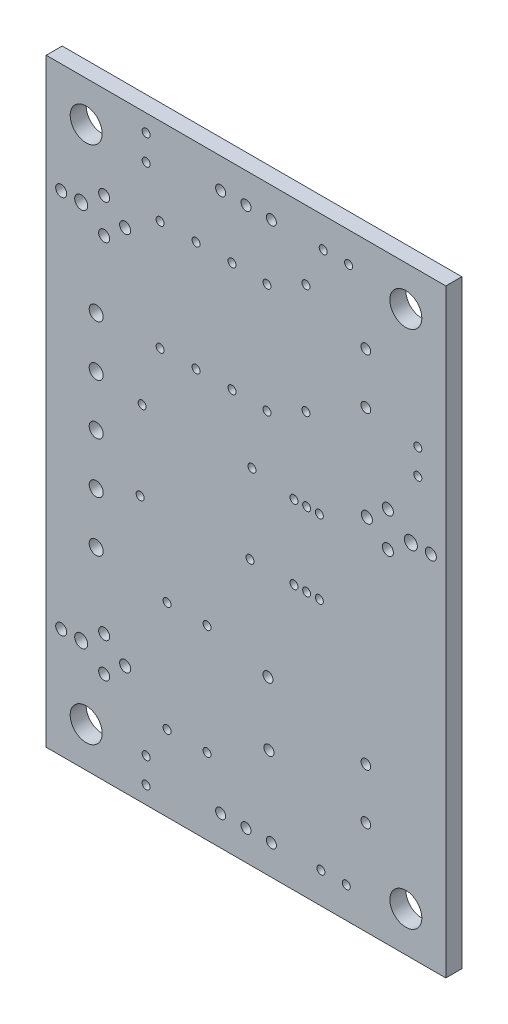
SolidWorks part; units mm, degrees
ref_plane "Plan de face" through (0, 0, 0) normal (0, 0, 1) x (1, 0, 0)
ref_plane "Plan de dessus" through (0, 0, 0) normal (0, 1, 0) x (1, 0, 0)
ref_plane "Plan de droite" through (0, 0, 0) normal (1, 0, 0) x (0, 0, -1)
sketch "Model" plane through (0, 0, 0) normal (0, 0, 1) x (1, 0, 0)
  line L314 (0, 60.0097) -> (40.0065, 60.0097)
  line L315 (40.0065, 60.0097) -> (40.0065, 0)
  line L316 (40.0065, 0) -> (0, 0)
  line L317 (0, 0) -> (0, 60.0097)
  circle A4 centre (37.2069, 42.1074) radius 0.3988
  circle A5 centre (37.2069, 44.6478) radius 0.3988
  circle A6 centre (5.0021, 35.0857) radius 0.7012
  circle A7 centre (5.0021, 40.1665) radius 0.7012
  circle A8 centre (5.0021, 30.0048) radius 0.7012
  circle A9 centre (5.0021, 24.924) radius 0.7012
  circle A10 centre (5.0021, 19.8432) radius 0.7012
  circle A11 centre (32.0042, 45.4684) radius 0.4827
  circle A12 centre (32.0042, 50.5492) radius 0.4827
  circle A13 centre (32.0042, 9.4605) radius 0.4827
  circle A14 centre (32.0042, 14.5413) radius 0.4827
  circle A15 centre (1.4988, 11.0025) radius 0.5513
  circle A16 centre (7.9007, 11.0025) radius 0.5513
  circle A17 centre (5.7998, 9.2522) radius 0.5513
  circle A18 centre (5.7998, 12.7529) radius 0.5513
  circle A19 centre (3.5007, 11.0025) radius 0.6503
  circle A20 centre (1.4988, 49.0097) radius 0.5513
  circle A21 centre (7.9007, 49.0097) radius 0.5513
  circle A22 centre (5.7998, 47.2594) radius 0.5513
  circle A23 centre (5.7998, 50.76) radius 0.5513
  circle A24 centre (3.5007, 49.0097) radius 0.6503
  circle A25 centre (38.5076, 36.0053) radius 0.5513
  circle A26 centre (32.1058, 36.0053) radius 0.5513
  circle A27 centre (34.2067, 37.7557) radius 0.5513
  circle A28 centre (34.2067, 34.255) radius 0.5513
  circle A29 centre (36.5058, 36.0053) radius 0.6503
  circle A30 centre (4.0012, 4.0012) radius 1.6005
  circle A31 centre (4.0012, 56.0085) radius 1.6005
  circle A32 centre (36.0053, 4.0012) radius 1.6005
  circle A33 centre (36.0053, 56.0085) radius 1.6005
  circle A34 centre (17.4628, 3.0002) radius 0.5005
  circle A35 centre (20.0032, 3.0002) radius 0.5005
  circle A36 centre (22.5436, 3.0002) radius 0.5005
  circle A37 centre (22.5436, 57.0095) radius 0.5005
  circle A38 centre (20.0032, 57.0095) radius 0.5005
  circle A39 centre (17.4628, 57.0095) radius 0.5005
  circle A40 centre (10.0016, 1.73) radius 0.3988
  circle A41 centre (10.0016, 4.2704) radius 0.3988
  circle A42 centre (27.5051, 3.0993) radius 0.3988
  circle A43 centre (30.0455, 3.0993) radius 0.3988
  circle A44 centre (10.0016, 55.7393) radius 0.3988
  circle A45 centre (10.0016, 58.2797) radius 0.3988
  circle A46 centre (27.7337, 57.0095) radius 0.3988
  circle A47 centre (30.2741, 57.0095) radius 0.3988
  circle A48 centre (26.0037, 42.1074) radius 0.3988
  circle A49 centre (26.0037, 53.1099) radius 0.3988
  circle A50 centre (12.1025, 7.6009) radius 0.3988
  circle A51 centre (12.1025, 18.6035) radius 0.3988
  circle A52 centre (22.1042, 51.2072) radius 0.3988
  circle A53 centre (22.1042, 40.2072) radius 0.3988
  circle A54 centre (9.6028, 34.5065) radius 0.3988
  circle A55 centre (20.6028, 34.5065) radius 0.3988
  circle A56 centre (16.1037, 7.6009) radius 0.3988
  circle A57 centre (16.1037, 18.6035) radius 0.3988
  circle A58 centre (11.4014, 40.3062) radius 0.3988
  circle A59 centre (11.4014, 51.3088) radius 0.3988
  circle A60 centre (9.4021, 26.5042) radius 0.3988
  circle A61 centre (20.4021, 26.5042) radius 0.3988
  circle A62 centre (18.6035, 51.3088) radius 0.3988
  circle A63 centre (18.6035, 40.3062) radius 0.3988
  circle A64 centre (15.0037, 51.3088) radius 0.3988
  circle A65 centre (15.0037, 40.3062) radius 0.3988
  circle A66 centre (24.8046, 26.5042) radius 0.3988
  circle A67 centre (26.0748, 26.5042) radius 0.3988
  circle A68 centre (27.345, 26.5042) radius 0.3988
  circle A69 centre (24.8046, 33.9044) radius 0.3988
  circle A70 centre (26.0748, 33.9044) radius 0.3988
  circle A71 centre (27.345, 33.9044) radius 0.3988
  circle A72 centre (22.3048, 10.9009) radius 0.5005
  circle A73 centre (22.2032, 17.2037) radius 0.5005
  dimension "D1" = 11
extrude "Boss.-Extru.1" add sketch "Model" along normal blind 1.6
